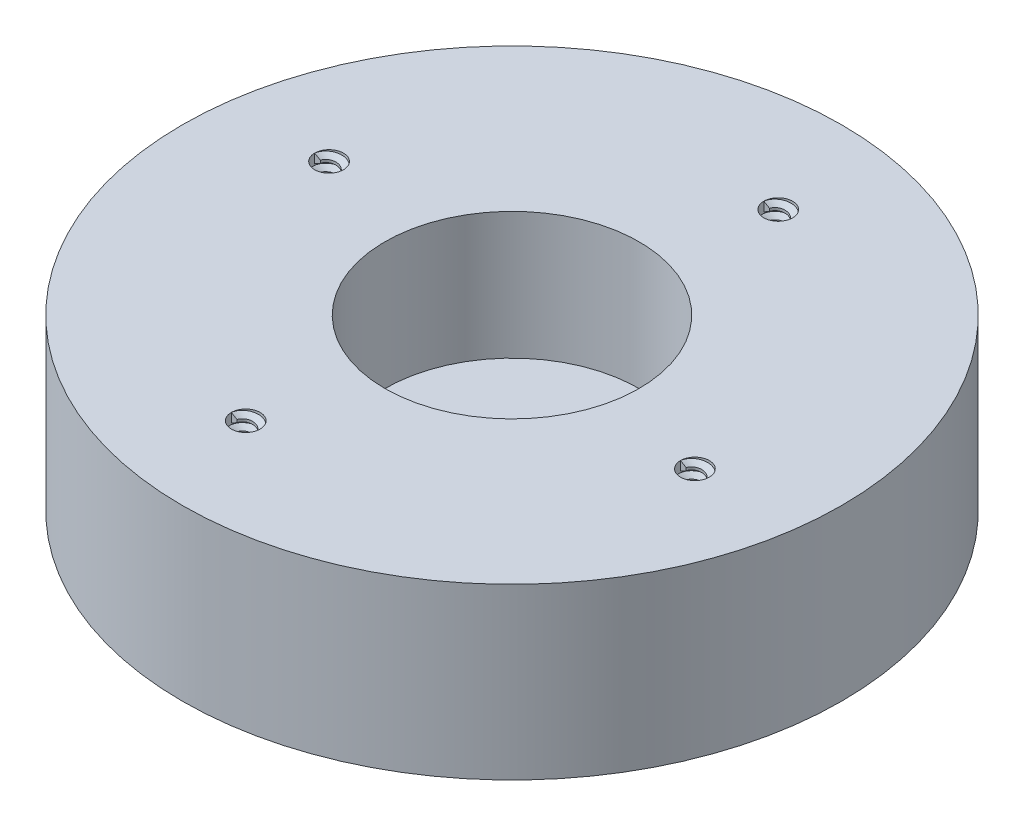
SolidWorks part; units mm, degrees
ref_plane "Plan de face" through (0, 0, 0) normal (0, 0, 1) x (1, 0, 0)
ref_plane "Plan de dessus" through (0, 0, 0) normal (0, 1, 0) x (1, 0, 0)
ref_plane "Plan de droite" through (0, 0, 0) normal (1, 0, 0) x (0, 0, -1)
sketch "Esquisse1" plane through (0, 0, 0) normal (0, 0, 1) x (1, 0, 0)
  line L0 (38.9, 53.4006) -> (38.9, 18.4006) construction
  line L1 (0, 33.4006) -> (0, 53.4006)
  line L2 (0, 53.4006) -> (38.9, 53.4006)
  line L3 (38.9, 53.4006) -> (38.9, 18.4006)
  line L4 (38.9, 18.4006) -> (0, 33.4006)
revolve "Révolution1" add sketch "Esquisse1" angle 360 about L0
sketch "Esquisse2" plane through (0, 53.4006, 0) normal (0, 1, 0) x (1, 0, 0)
  line L0 (0.6527, 7.0959) -> (77.1473, -7.0959)
  line L1 (77.1473, -7.0959) -> (38.9, 0)
  line L2 (38.9, 0) -> (31.8041, -38.2473)
  line L3 (31.8041, -38.2473) -> (45.9959, 38.2473)
  line L4 (0.6527, 7.0959) -> (38.9, 0)
  line L5 (38.9, 0) -> (77.1473, -7.0959)
  line L6 (38.9, 0) -> (45.9959, 38.2473)
  circle A0 centre (38.9, 0) radius 38.9 construction
  point P7 (19.7763, 3.5479)
  point P8 (35.3521, -19.1237)
  point P9 (58.0237, -3.5479)
  point P10 (42.4479, 19.1237)
  point P11 (0, 0)
  point P12 (0, 0)
sketch "Esquisse19" plane through (0, 53.4006, 0) normal (0, 1, 0) x (1, 0, 0)
  circle A0 centre (38.9, 0) radius 15
extrude "Enlèv. mat.-Extru.1" cut sketch "Esquisse19" against normal blind 15
sketch "Esquisse20" plane through (0, 53.4006, 0) normal (0, 1, 0) x (1, 0, 0)
  line L0 (24.1517, 2.7362) -> (0.6527, 7.0959)
  line L1 (0.6527, 7.0959) -> (77.1473, -7.0959) construction
  line L2 (0.6527, 7.0959) -> (31.8041, -38.2473) construction
  line L3 (31.8041, -38.2473) -> (36.1638, -14.7483)
  line L4 (38.9, 0) -> (31.8041, -38.2473) construction
  line L5 (38.9, 0) -> (16.2284, -15.5757) construction
  line L6 (45.9959, 38.2473) -> (41.6362, 14.7483)
  line L7 (77.1473, -7.0959) -> (53.6483, -2.7362)
  circle A0 centre (38.9, 0) radius 15 construction
  circle A1 centre (38.9, 0) radius 15 construction
  point P8 (12.4022, 4.916)
  point P14 (33.984, -26.4978)
  point P15 (16.2284, -15.5757)
  point P25 (43.816, 26.4978)
  point P26 (65.3978, -4.916)
hole_wizard "Dégagement M32" positions "Esquisse21" profile "Esquisse22" hole size "M3" standard "AS"
sketch "Esquisse21" plane through (0, 53.4006, 0) normal (0, 1, 0) x (1, 0, 0)
  point P0 (43.816, 26.4978)
  point P3 (65.3978, -4.916)
  point P6 (33.984, -26.4978)
  point P9 (12.4022, 4.916)
sketch "Esquisse22" plane through (43.816, 53.4006, -26.4978) normal (1, 0, 0) x (0, 0, 1)
  line L0 (0, 0) -> (0, 15)
  line L1 (0, 15) -> (1.7, 15)
  line L2 (1.7, 15) -> (1.7, 0)
  line L5 (1.7, 0) -> (0, 0)
  line L10 (0, 15) -> (-1.7, 15) construction
  line L11 (0, -6.35) -> (0, 107.95) construction
  dimension "Diamètre du perçage" = 3.4
  dimension "Profondeur du perçage" = 15
  dimension "Angle de pointe" = 180
thread "Filetage6" pitch 1.25 start angle 0, offset 0, length 15, pitch 1.25, diameter 3.4
ref_plane "Plan6" through (42.116, 53.4006, -26.4978) normal (0, 0, 1) x (-1, 0, 0)
sketch "Profil de filetage6" plane through (42.116, 53.4006, -26.4978) normal (0, 0, 1) x (-1, 0, 0)
  line L0 (0, 0) -> (0, 1.25) construction
  line L11 (0, 0) -> (0, 1.0937)
  line L12 (0, 1.0937) -> (-0.6766, 0.7031)
  line L13 (-0.6766, 0.7031) -> (-0.6766, 0.3906)
  line L15 (-0.6766, 0.3906) -> (0, 0)
  line L17 (-0.6766, 0.5469) -> (0, 0.5469) construction
  point P2 (0, 0)
  dimension "Pitch" = 1.25
  dimension "Profile_Angle" = 60
  dimension "Profile_Land" = 0.3125
  dimension "Profile_Height" = 0.6766
thread "Filetage7" pitch 1.25 start angle 0, offset 0, length 15, pitch 1.25, diameter 3.4
ref_plane "Plan7" through (10.7022, 53.4006, -4.916) normal (0, 0, 1) x (-1, 0, 0)
sketch "Profil de filetage7" plane through (10.7022, 53.4006, -4.916) normal (0, 0, 1) x (-1, 0, 0)
  line L0 (0, 0) -> (0, 1.25) construction
  line L11 (0, 0) -> (0, 1.0937)
  line L12 (0, 1.0937) -> (-0.6766, 0.7031)
  line L13 (-0.6766, 0.7031) -> (-0.6766, 0.3906)
  line L15 (-0.6766, 0.3906) -> (0, 0)
  line L17 (-0.6766, 0.5469) -> (0, 0.5469) construction
  point P2 (0, 0)
  dimension "Pitch" = 1.25
  dimension "Profile_Angle" = 60
  dimension "Profile_Land" = 0.3125
  dimension "Profile_Height" = 0.6766
thread "Filetage8" pitch 1.25 start angle 0, offset 0, length 15, pitch 1.25, diameter 3.4
ref_plane "Plan8" through (63.6978, 53.4006, 4.916) normal (0, 0, 1) x (-1, 0, 0)
sketch "Profil de filetage8" plane through (63.6978, 53.4006, 4.916) normal (0, 0, 1) x (-1, 0, 0)
  line L0 (0, 0) -> (0, 1.25) construction
  line L11 (0, 0) -> (0, 1.0937)
  line L12 (0, 1.0937) -> (-0.6766, 0.7031)
  line L13 (-0.6766, 0.7031) -> (-0.6766, 0.3906)
  line L15 (-0.6766, 0.3906) -> (0, 0)
  line L17 (-0.6766, 0.5469) -> (0, 0.5469) construction
  point P2 (0, 0)
  dimension "Pitch" = 1.25
  dimension "Profile_Angle" = 60
  dimension "Profile_Land" = 0.3125
  dimension "Profile_Height" = 0.6766
thread "Filetage9" pitch 1.25 start angle 0, offset 0, length 15, pitch 1.25, diameter 3.4
ref_plane "Plan9" through (32.284, 53.4006, 26.4978) normal (0, 0, 1) x (-1, 0, 0)
sketch "Profil de filetage9" plane through (32.284, 53.4006, 26.4978) normal (0, 0, 1) x (-1, 0, 0)
  line L0 (0, 0) -> (0, 1.25) construction
  line L11 (0, 0) -> (0, 1.0937)
  line L12 (0, 1.0937) -> (-0.6766, 0.7031)
  line L13 (-0.6766, 0.7031) -> (-0.6766, 0.3906)
  line L15 (-0.6766, 0.3906) -> (0, 0)
  line L17 (-0.6766, 0.5469) -> (0, 0.5469) construction
  point P2 (0, 0)
  dimension "Pitch" = 1.25
  dimension "Profile_Angle" = 60
  dimension "Profile_Land" = 0.3125
  dimension "Profile_Height" = 0.6766
